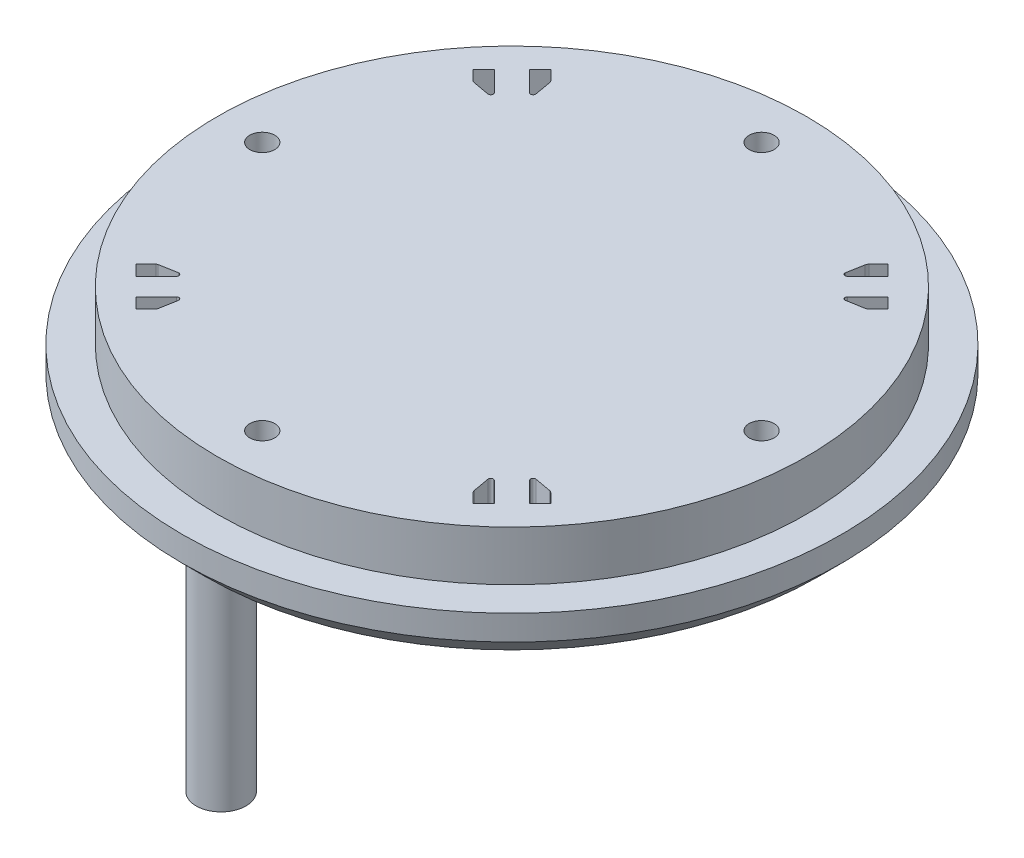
SolidWorks part; units mm, degrees
ref_plane "Front Plane" through (0, 0, 0) normal (0, 0, 1) x (1, 0, 0)
ref_plane "Top Plane" through (0, 0, 0) normal (0, 1, 0) x (1, 0, 0)
ref_plane "Right Plane" through (0, 0, 0) normal (1, 0, 0) x (0, 0, -1)
sketch "Sketch1" plane through (0, 0, 0) normal (0, 1, 0) x (1, 0, 0)
  circle A0 centre (0, 0) radius 33
  dimension "D1" = 66
extrude "Boss-Extrude1" add sketch "Sketch1" along normal blind 5
sketch "Sketch2" plane through (0, 5, 0) normal (0, 1, 0) x (1, 0, 0)
  circle A0 centre (0, 0) radius 29.5
  dimension "D1" = 59
extrude "Boss-Extrude2" add sketch "Sketch2" along normal blind 5
sketch "Sketch3" plane through (0, 0, 0) normal (0, -1, 0) x (1, 0, 0)
  circle A0 centre (0, 0) radius 30.75
  dimension "D1" = 61.5
extrude "Cut-Extrude1" cut sketch "Sketch3" against normal blind 3.5 draft 15
sketch "Sketch4" plane through (0, 3.5, 0) normal (0, -1, 0) x (1, 0, 0)
  circle A0 centre (0, 0) radius 25 construction
  circle A1 centre (0, 25) radius 1.25
  circle A2 centre (25, 0) radius 1.25
  circle A3 centre (0, -25) radius 1.25
  circle A4 centre (-25, 0) radius 1.25
  point P14 (0, 0)
  dimension "D1" = 50
  dimension "D2" = 2.5
  dimension "D3" = 4
extrude "Cut-Extrude2" cut sketch "Sketch4" against normal through all
chamfer "Chamfer1" distance 2.5 angle 45 1 edges at (0, 0, 33)
fillet "Fillet1" radius 1 1 edges at (0, 3.5, -29.8122)
sketch "Sketch5" plane through (0, 3.5, 0) normal (0, -1, 0) x (1, 0, 0)
  circle A0 centre (-7.2688, 21.8512) radius 2.5
  circle A1 centre (-7.2688, 21.8512) radius 2
  dimension "D1" = 5
  dimension "D2" = 4
extrude "Boss-Extrude3" add sketch "Sketch5" along normal blind 30
sketch "Sketch6" plane through (0, 3.5, 0) normal (0, -1, 0) x (1, 0, 0)
  line L0 (0, 25) -> (25, 0) construction
  line L1 (12.5, 12.5) -> (20.3221, 20.3221) construction
  line L2 (19.7121, 17.9443) -> (20.7728, 16.8837)
  line L3 (20.7728, 16.8837) -> (19.8228, 15.9338)
  line L4 (19.558, 15.7952) -> (17.9099, 15.4982)
  line L5 (17.6888, 15.921) -> (19.7121, 17.9443)
  line L6 (16.8837, 20.7728) -> (15.9338, 19.8228)
  line L7 (15.7952, 19.558) -> (15.4982, 17.9099)
  line L8 (17.9443, 19.7121) -> (16.8837, 20.7728)
  line L9 (15.921, 17.6888) -> (17.9443, 19.7121)
  line L10 (17.9443, -19.7121) -> (16.8837, -20.7728)
  line L11 (16.8837, -20.7728) -> (15.9338, -19.8228)
  line L12 (15.7952, -19.558) -> (15.4982, -17.9099)
  line L13 (15.921, -17.6888) -> (17.9443, -19.7121)
  line L14 (20.7728, -16.8837) -> (19.8228, -15.9338)
  line L15 (19.558, -15.7952) -> (17.9099, -15.4982)
  line L16 (19.7121, -17.9443) -> (20.7728, -16.8837)
  line L17 (17.6888, -15.921) -> (19.7121, -17.9443)
  line L18 (12.5, -12.5) -> (20.3221, -20.3221) construction
  line L19 (-19.7121, -17.9443) -> (-20.7728, -16.8837)
  line L20 (-20.7728, -16.8837) -> (-19.7675, -15.8784)
  line L21 (-19.635, -15.8091) -> (-17.9099, -15.4982)
  line L22 (-17.6888, -15.921) -> (-19.7121, -17.9443)
  line L23 (-16.8837, -20.7728) -> (-15.8784, -19.7675)
  line L24 (-15.8091, -19.635) -> (-15.4982, -17.9099)
  line L25 (-17.9443, -19.7121) -> (-16.8837, -20.7728)
  line L26 (-15.921, -17.6888) -> (-17.9443, -19.7121)
  line L27 (-12.5, -12.5) -> (-20.3221, -20.3221) construction
  line L28 (-17.9443, 19.7121) -> (-16.8837, 20.7728)
  line L29 (-16.8837, 20.7728) -> (-15.8784, 19.7675)
  line L30 (-15.8091, 19.635) -> (-15.4982, 17.9099)
  line L31 (-15.921, 17.6888) -> (-17.9443, 19.7121)
  line L32 (-20.7728, 16.8837) -> (-19.7675, 15.8784)
  line L33 (-19.635, 15.8091) -> (-17.9099, 15.4982)
  line L34 (-19.7121, 17.9443) -> (-20.7728, 16.8837)
  line L35 (-17.6888, 15.921) -> (-19.7121, 17.9443)
  line L36 (-12.5, 12.5) -> (-20.3221, 20.3221) construction
  arc A0 (15.4982, 17.9099) -> (15.921, 17.6888) centre (15.7443, 17.8656) ccw
  arc A1 (17.9099, 15.4982) -> (17.6888, 15.921) centre (17.8656, 15.7443) cw
  arc A2 (15.9338, 19.8228) -> (15.7952, 19.558) centre (16.2873, 19.4693) ccw
  arc A3 (19.8228, 15.9338) -> (19.558, 15.7952) centre (19.4693, 16.2873) cw
  arc A4 (-17.9099, 15.4982) -> (-17.6888, 15.921) centre (-17.8656, 15.7443) ccw
  arc A5 (-15.4982, 17.9099) -> (-15.921, 17.6888) centre (-15.7443, 17.8656) cw
  arc A6 (-19.7675, 15.8784) -> (-19.635, 15.8091) centre (-19.5907, 16.0552) ccw
  arc A7 (-15.8784, 19.7675) -> (-15.8091, 19.635) centre (-16.0552, 19.5907) cw
  arc A8 (-17.9099, -15.4982) -> (-17.6888, -15.921) centre (-17.8656, -15.7443) cw
  arc A9 (-15.4982, -17.9099) -> (-15.921, -17.6888) centre (-15.7443, -17.8656) ccw
  arc A10 (-19.7675, -15.8784) -> (-19.635, -15.8091) centre (-19.5907, -16.0552) cw
  arc A11 (-15.8784, -19.7675) -> (-15.8091, -19.635) centre (-16.0552, -19.5907) ccw
  arc A12 (15.4982, -17.9099) -> (15.921, -17.6888) centre (15.7443, -17.8656) cw
  arc A13 (17.9099, -15.4982) -> (17.6888, -15.921) centre (17.8656, -15.7443) ccw
  arc A14 (19.8228, -15.9338) -> (19.558, -15.7952) centre (19.4693, -16.2873) ccw
  arc A15 (15.9338, -19.8228) -> (15.7952, -19.558) centre (16.2873, -19.4693) cw
  point P4 (17.602, 17.602)
  point P17 (15.3567, 17.1244)
  point P18 (17.602, -17.602)
  point P29 (-17.602, -17.602)
  point P40 (-17.602, 17.602)
  point P51 (0, 0)
  point P54 (17.1244, 15.3567)
  point P57 (15.823, 19.7121)
  point P60 (19.7121, 15.823)
  dimension "D5" = 0.25
  dimension "D6" = 0.5
  dimension "D7" = 0.25
  dimension "D8" = 0.25
  dimension "D9" = 0.25
  dimension "D10" = 0.5
  dimension "D1" = 1.5
  dimension "D2" = 1.5
  dimension "D3" = 1.25
  dimension "D4" = 4
extrude "Cut-Extrude3" cut sketch "Sketch6" against normal through all
